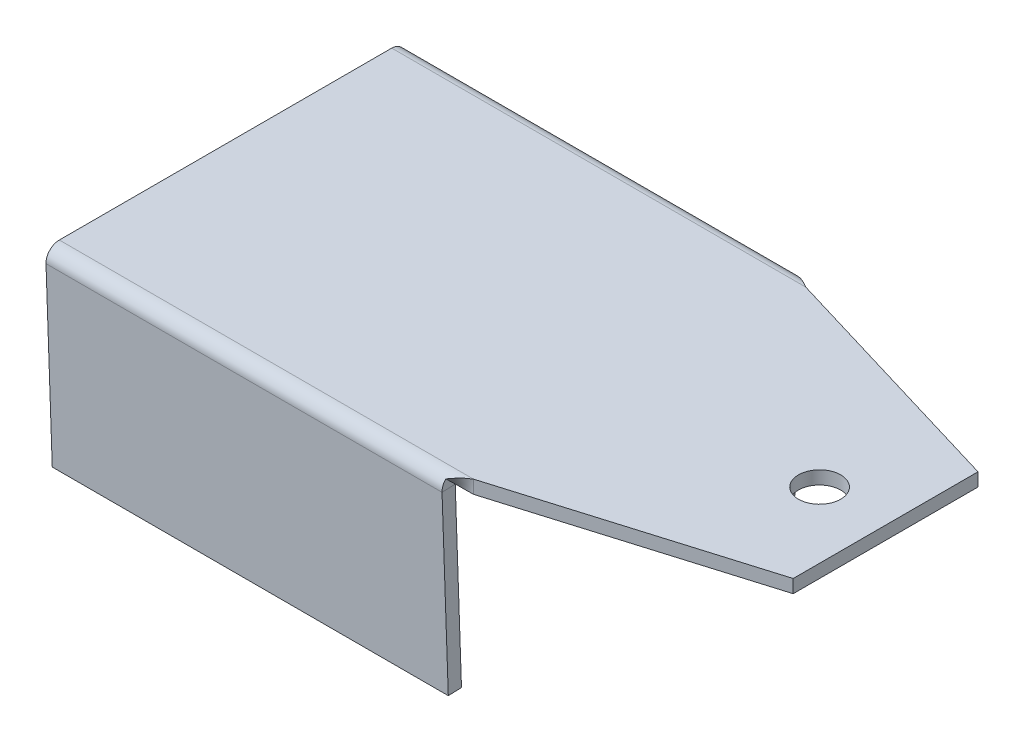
SolidWorks part; units mm, degrees
ref_plane "Front" through (0, 0, 0) normal (0, 0, 1) x (1, 0, 0)
ref_plane "Top" through (0, 0, 0) normal (0, 1, 0) x (1, 0, 0)
ref_plane "Right" through (0, 0, 0) normal (1, 0, 0) x (0, 0, -1)
sketch "Sketch1" plane through (0, 0, 0) normal (0, 1, 0) x (1, 0, 0)
  line L0 (30, 40) -> (30, 54)
  line L1 (0, 0) -> (30, 0)
  line L2 (0, 0) -> (0, 54)
  line L3 (0, 54) -> (30, 54)
  line L4 (50, 20) -> (50, 34)
  line L5 (30, 0) -> (30, 54) construction
  line L6 (30, 0) -> (30, 14)
  line L10 (30, 40) -> (50, 34)
  line L11 (50, 20) -> (30, 14)
  circle A0 centre (45, 27) radius 1.6
sheet metal parameters "Sheet-Metal1" thickness 1 parameters "D1"=0.01
base flange "Base-Flange1" sketch "Sketch1" thickness 1 reverse thickness direction yes parameters "D1"=0.01
sketch "Sketch3" plane through (0, 1, 0) normal (0, 1, 0) x (-1, 0, 0)
  line L0 (-30, -40) -> (0, -40)
  line L1 (0, -54) -> (0, 0) construction
  line L2 (-30, -14) -> (0, -14)
sketched bend "Sketched Bend1" parameters "D1"=0
bend "SketchBend1" bend radius 0.01 bend angle 92 parameters "D5"=1
bend "SketchBend2" bend radius 0 bend angle 92 parameters "D5"=2
flat pattern "Flat-Pattern1"
sketch "Bend-Lines1" plane through (0, 1, 0) normal (0, 1, 0) x (-1, 0, 0)
  line L0 (0, -14) -> (-30, -14) construction
  line L1 (0, -40) -> (-30, -40) construction
bend of the flat pattern "Flatten-<SketchBend1>1"
bend of the flat pattern "Flatten-<SketchBend2>1"
